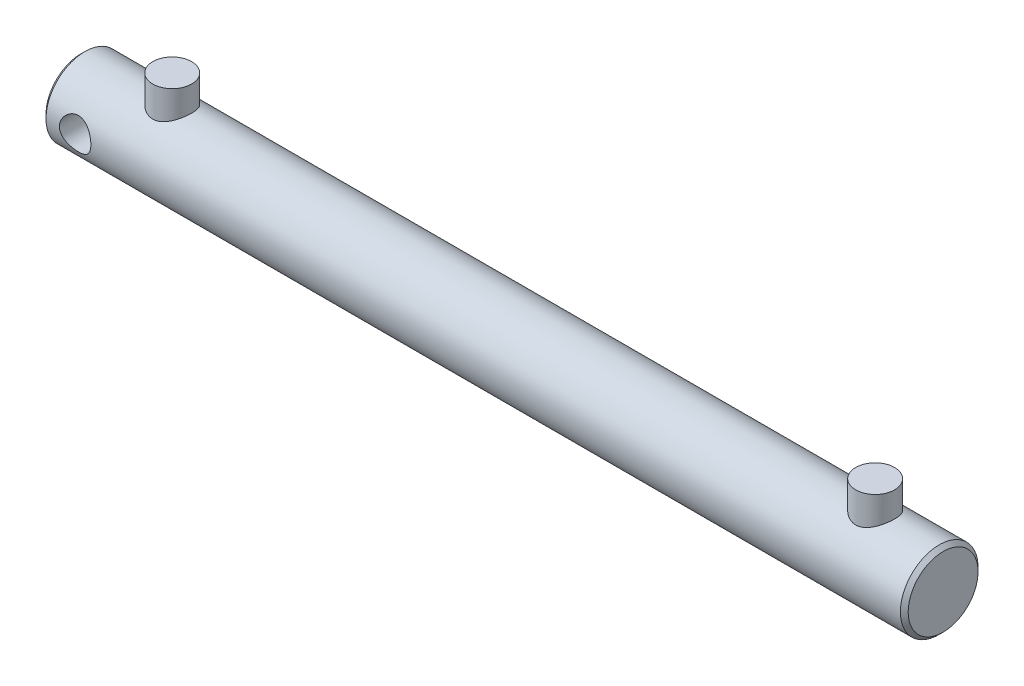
SolidWorks part; units mm, degrees
ref_plane "Plan de face" through (0, 0, 0) normal (0, 0, 1) x (1, 0, 0)
ref_plane "Plan de dessus" through (0, 0, 0) normal (0, 1, 0) x (1, 0, 0)
ref_plane "Plan de droite" through (0, 0, 0) normal (1, 0, 0) x (0, 0, -1)
sketch "Esquisse1" plane through (0, 0, 0) normal (0, 0, 1) x (1, 0, 0)
  line L0 (-222, 0) -> (222, 0) construction
  line L1 (-222, 0) -> (-222, 20)
  line L2 (-222, 20) -> (222, 20)
  line L3 (222, 20) -> (222, 0)
  line L6 (-222, 0) -> (222, 0)
  dimension "D1" = 40
  dimension "D3" = 444
revolve "Révolution1" add sketch "Esquisse1" angle 360 about L0
chamfer "Chanfrein1" distance 2 angle 45 2 edges at (222, 0, 20) (-222, 0, 20)
sketch "Esquisse3" plane through (0, 0, 0) normal (0, 0, 1) x (1, 0, 0)
  line L0 (-222, 18) -> (-222, -18) construction
  circle A0 centre (-205, 0) radius 8.1
  dimension "D1" = 16.2
  dimension "D2" = 17
extrude "Enlèv. mat.-Extru.1" cut sketch "Esquisse3" against normal through all and the other way through all
sketch "Esquisse5" plane through (0, 0, 0) normal (0, 1, 0) x (1, 0, 0)
  line L0 (-222, 18) -> (-222, -18) construction
  line L1 (222, -18) -> (222, 18) construction
  circle A0 centre (-175, 0) radius 10
  circle A1 centre (187, 0) radius 10
  dimension "D1" = 20
  dimension "D2" = 47
  dimension "D3" = 35
extrude "Extrusion2" add sketch "Esquisse5" along normal blind 33
